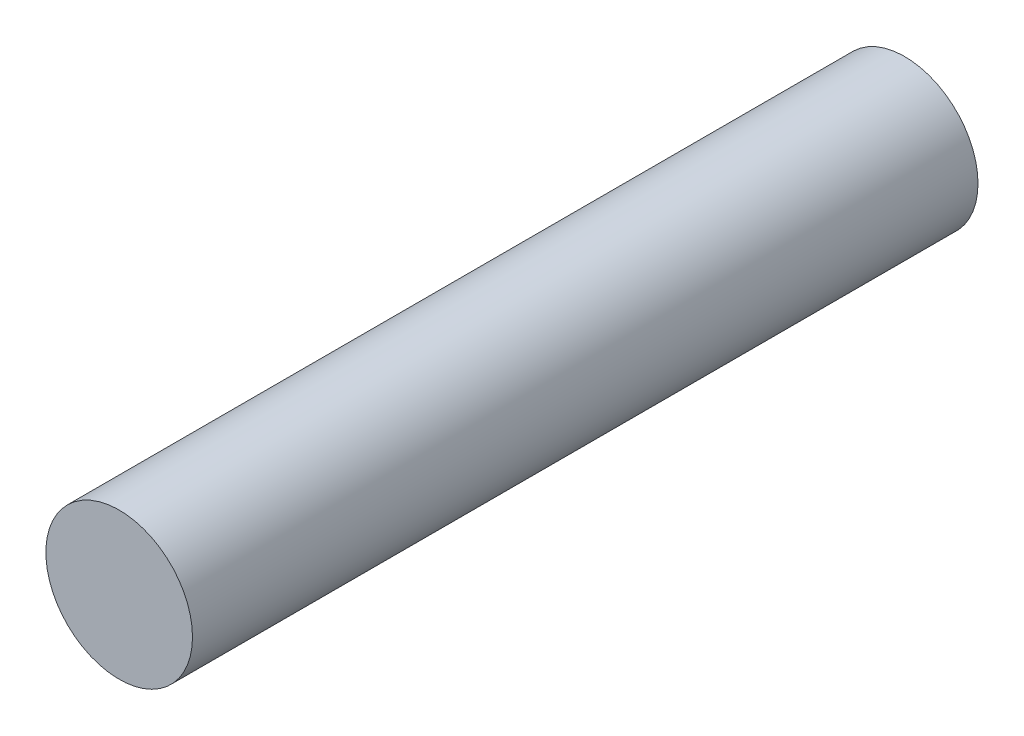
SolidWorks part; units mm, degrees
ref_plane "Front Plane" through (0, 0, 0) normal (0, 0, 1) x (1, 0, 0)
ref_plane "Top Plane" through (0, 0, 0) normal (0, 1, 0) x (1, 0, 0)
ref_plane "Right Plane" through (0, 0, 0) normal (1, 0, 0) x (0, 0, -1)
sketch "Sketch1" plane through (0, 0, 0) normal (0, 0, 1) x (1, 0, 0)
  circle A0 centre (0, 0) radius 7
extrude "Boss-Extrude1" add sketch "Sketch1" along normal blind 75
